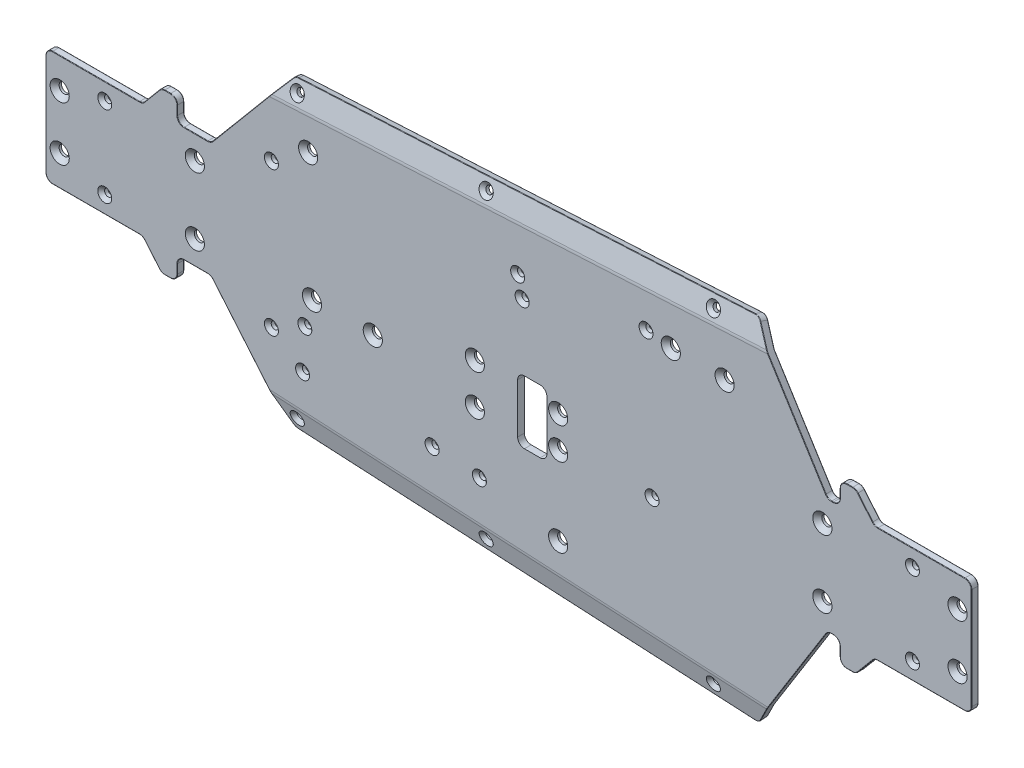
SolidWorks part; units mm, degrees
ref_plane "Plan1" through (0, 0, 0) normal (0, 0, 1) x (1, 0, 0)
ref_plane "Plan2" through (0, 0, 0) normal (0, 1, 0) x (1, 0, 0)
ref_plane "Plan3" through (0, 0, 0) normal (1, 0, 0) x (0, 0, -1)
sketch "Esquisse1" plane through (0, 0, 0) normal (0, 0, 1) x (1, 0, 0)
  line L0 (0, 0) -> (-224.5054, 0) construction
  line L1 (-205.5, 0) -> (-205.5, -25.5)
  line L2 (109, -77.8171) -> (141.6913, -25.5)
  line L3 (-205.5, -25.5) -> (-162.5, -25.5)
  line L4 (205.5, 0) -> (-205.5, 0)
  line L5 (0, 0) -> (218.3589, 0) construction
  line L6 (-162.5, -25.5) -> (-154.109, -35.5)
  line L7 (-154.109, -35.5) -> (-147.109, -35.5)
  line L8 (-132.225, -25.5) -> (-97.4024, -67)
  line L9 (-97.4024, -67) -> (109, -77.8171)
  line L10 (-147.109, -35.5) -> (-147.109, -25.5)
  line L11 (-147.109, -25.5) -> (-132.225, -25.5)
  line L12 (0, 0) -> (0, -125.8853) construction
  line L13 (147.109, -35.5) -> (147.109, -25.5)
  line L14 (154.109, -35.5) -> (147.109, -35.5)
  line L15 (162.5, -25.5) -> (154.109, -35.5)
  line L16 (205.5, -25.5) -> (162.5, -25.5)
  line L17 (205.5, 0) -> (205.5, -25.5)
  line L18 (147.109, -25.5) -> (141.6913, -25.5)
  dimension "D1" = 205.5
  dimension "D2" = 10
  dimension "D3" = 25.5
  dimension "D4" = 43
  dimension "D5" = 7
  dimension "D6" = 130
  dimension "D7" = 58
  dimension "D8" = 77.8171
  dimension "D9" = 109
  dimension "D10" = 3
  dimension "D11" = 50
  dimension "D12" = 67
extrude "Extrusion1" add sketch "Esquisse1" along normal blind 3
mirror "Symétrie1"
ref_plane "Plan4" through (112.7685, -5.9099, 0) normal (-0.9986, 0.0523, 0) x (0, 0, 1)
sketch "Esquisse2" plane through (112.7685, -5.9099, 0) normal (-0.9986, 0.0523, 0) x (0, 0, 1)
  line L0 (0, -32.3852) -> (0, -72.0058) construction
  line L1 (3, -72.0058) -> (0, -72.0058)
  line L2 (3, -72.0058) -> (3, -62.3742)
  line L4 (0, -72.0058) -> (0, -62.0058)
  line L5 (0, -62.0058) -> (3, -62.3742)
  dimension "D1" = 83
  dimension "D2" = 10
extrude "Enlèv. mat.-Extru.1" cut sketch "Esquisse2" against normal mid plane 460
ref_plane "Plan5" through (118.304, -6.2, 0) normal (-0.9986, 0.0523, 0) x (0, 0, 1)
sketch "Esquisse3" plane through (118.304, -6.2, 0) normal (-0.9986, 0.0523, 0) x (0, 0, 1)
  line L0 (0, -62.0058) -> (-2.4192, -71.7088)
  line L1 (-2.4192, -71.7088) -> (0.4917, -72.4345)
  line L2 (0.4917, -72.4345) -> (3, -62.3742)
  line L3 (0, -62.0058) -> (3, -62.3742)
  dimension "D1" = 3
  dimension "D2" = 10
extrude "Extrusion2" add sketch "Esquisse3" along normal blind 230
sketch "Esquisse4" plane through (0, 0, 0) normal (0, 0, -1) x (-1, 0, 0)
  line L0 (-115.0589, -68.1209) -> (-141.6913, -25.5) construction
  line L1 (-108.7437, -78.2272) -> (-115.0589, -68.1209)
  line L4 (-115.0589, -68.1209) -> (-129.6869, -68.1209)
  line L5 (-129.6869, -68.1209) -> (-129.6869, -85.1421)
  line L6 (-129.6869, -85.1421) -> (-108.7437, -85.1421)
  line L7 (-108.7437, -85.1421) -> (-108.7437, -78.2272)
extrude "Enlèv. mat.-Extru.2" cut sketch "Esquisse4" against normal mid plane 20
sketch "Esquisse6" plane through (0, 0, 0) normal (0, 0, -1) x (-1, 0, 0)
  line L0 (115.1717, -66.4981) -> (-108.7437, -78.233) construction
  line L1 (132.225, -25.5) -> (106.1914, -56.5257) construction
  line L2 (115.1717, -66.4981) -> (97.0256, -67.4491)
  line L3 (106.1914, -56.5257) -> (97.0256, -67.4491)
  line L4 (114.6259, -56.0836) -> (106.1914, -56.5257) construction
  line L5 (114.6259, -56.0836) -> (106.1914, -56.5257)
  line L6 (114.6259, -56.0836) -> (115.1338, -65.7733) construction
  line L7 (114.6259, -56.0836) -> (115.1717, -66.4981)
extrude "Enlèv. mat.-Extru.4" cut sketch "Esquisse6" against normal mid plane 50
mirror "Symétrie2" about plane through (0, 0, 0) normal (0, 1, 0)
fillet "Congé1" radius 2
fillet "Congé2" radius 5
fillet "Congé3" radius 3
fillet "Congé4" radius 0.2
sketch "Esquisse7" plane through (0, 0, 3) normal (0, 0, 1) x (1, 0, 0)
  line L0 (0, 0) -> (-260.5389, 0) construction
  line L1 (34.5635, -8.5) -> (-29.6344, -8.5) construction
  line L2 (7, 5.5) -> (14, 5.5)
  line L3 (4, 2.5) -> (4, -19.5)
  line L4 (7, -22.5) -> (14, -22.5)
  line L5 (17, 2.5) -> (17, -19.5)
  line L6 (22, -15.5) -> (22, -60.6372) construction
  line L7 (-205.3, 22.5) -> (-205.3, -22.5) construction
  line L8 (0, 0) -> (0, 113.8341) construction
  line L9 (-87.3, -12.5) -> (-46.2143, -12.5) construction
  arc A0 (4, 2.5) -> (7, 5.5) centre (7, 2.5) cw
  arc A1 (17, 2.5) -> (14, 5.5) centre (14, 2.5) ccw
  arc A2 (14, -22.5) -> (17, -19.5) centre (14, -19.5) ccw
  arc A3 (4, -19.5) -> (7, -22.5) centre (7, -19.5) ccw
  circle A4 centre (-15, -17.5) radius 2.25
  circle A5 centre (22, -15.5) radius 2.25
  circle A6 centre (-15, 0.5) radius 2.25
  circle A7 centre (22, -1.5) radius 2.25
  circle A8 centre (22, -50.5) radius 2.25
  circle A9 centre (-60.3, -12.5) radius 2.25
  circle A10 centre (-87.3, -12.5) radius 2.25
  circle A11 centre (72.0019, 48.5769) radius 2.25
  circle A12 centre (-89, 43.3803) radius 2.25
  circle A13 centre (95.9019, 48.3169) radius 2.25
  circle A14 centre (-139.3, 15) radius 2.25
  circle A15 centre (-199.3, 12) radius 2.25
  circle A16 centre (-179.3, 18) radius 1.6
  circle A17 centre (-179.3, -18) radius 1.6
  circle A18 centre (-199.3, -12) radius 2.25
  circle A19 centre (-139.3, -15) radius 2.25
  circle A20 centre (-105.3, 32) radius 1.6
  circle A21 centre (-105.3, -32) radius 1.6
  circle A22 centre (139.3, -15) radius 2.25
  circle A23 centre (199.3, -12) radius 2.25
  circle A24 centre (179.3, -18) radius 1.6
  circle A25 centre (179.3, 18) radius 1.6
  circle A26 centre (199.3, 12) radius 2.25
  circle A27 centre (139.3, 15) radius 2.25
  circle A28 centre (6, 34.5713) radius 1.6
  circle A29 centre (3.9995, 43.0713) radius 1.6
  circle A30 centre (61, 50.0638) radius 1.6
  circle A31 centre (63.6874, -13) radius 1.6
  circle A32 centre (-12.9743, -43.7003) radius 1.6
  circle A33 centre (-33.9743, -42.2003) radius 1.6
  circle A34 centre (-90.4743, -24.2003) radius 1.6
  circle A35 centre (-91.4743, -42.2003) radius 1.6
  dimension "D1" = 3
  dimension "D5" = 4.5
  dimension "D6" = 4.5
  dimension "D9" = 4.5
  dimension "D15" = 4.5
  dimension "D16" = 4.5
  dimension "D17" = 4.5
  dimension "D18" = 4.5
  dimension "D19" = 4.5
  dimension "D20" = 4.5
  dimension "D21" = 4.5
  dimension "D22" = 3.2
  dimension "D29" = 3.2
  dimension "D32" = 3.2
  dimension "D33" = 3.2
  dimension "D34" = 3.2
  dimension "D35" = 3.2
  dimension "D36" = 3.2
  dimension "D37" = 3.2
  dimension "D38" = 3.2
  dimension "D39" = 3.2
  dimension "D2" = 8.5
  dimension "D3" = 7
  dimension "D4" = 9
  dimension "D7" = 15
  dimension "D8" = 37
  dimension "D10" = 35
  dimension "D11" = 13
  dimension "D12" = 4
  dimension "D13" = 14
  dimension "D14" = 14
  dimension "D23" = 24
  dimension "D24" = 6
  dimension "D25" = 30
  dimension "D26" = 60
  dimension "D27" = 36
  dimension "D28" = 26
  dimension "D30" = 64
  dimension "D31" = 100
  dimension "D40" = 27
  dimension "D41" = 12.5
  dimension "D42" = 52
  dimension "D43" = 18
  dimension "D44" = 1
  dimension "D45" = 78.5
  dimension "D46" = 21
  dimension "D47" = 1.5
  dimension "D48" = 24.2003
  dimension "D49" = 90.4743
  dimension "D50" = 19.5
  dimension "D51" = 89
  dimension "D52" = 93
  dimension "D53" = 95
  dimension "D54" = 8.5
  dimension "D55" = 11.0019
  dimension "D56" = 95.9019
  dimension "D57" = 48.3169
  dimension "D58" = 13
  dimension "D59" = 23.9
  dimension "D60" = 0.26
  dimension "D61" = 1.487
extrude "Enlèv. mat.-Extru.5" cut sketch "Esquisse7" against normal through all
chamfer "Chanfrein1" distance 2 angle 45
chamfer "Chanfrein2" distance 1.5 angle 45
sketch "Esquisse8" plane through (-0.1899, 3.624, 14.555) normal (0.0127, -0.2416, -0.9703) x (-0.9999, -0.0046, -0.0119)
  line L0 (119.0741, 59.1786) -> (-155.099, 72.6809) construction
  line L1 (-109.0137, 75.4174) -> (96.6436, 65.2893) construction
  circle A0 centre (-90, 69.475) radius 1.6
  circle A1 centre (10.8777, 64.507) radius 1.6
  circle A2 centre (94.7761, 60.3753) radius 1.6
  dimension "D2" = 3.2
  dimension "D3" = 3.2
  dimension "D4" = 3.2
  dimension "D1" = 5
  dimension "D5" = 101
  dimension "D6" = 84
  dimension "D7" = 90
extrude "Enlèv. mat.-Extru.6" cut sketch "Esquisse8" against normal through all
mirror "Symétrie3" about plane through (0, 0, 0) normal (0, 1, 0)
chamfer "Chanfrein3" distance 1.5 angle 45
fillet "Congé5" radius 3
